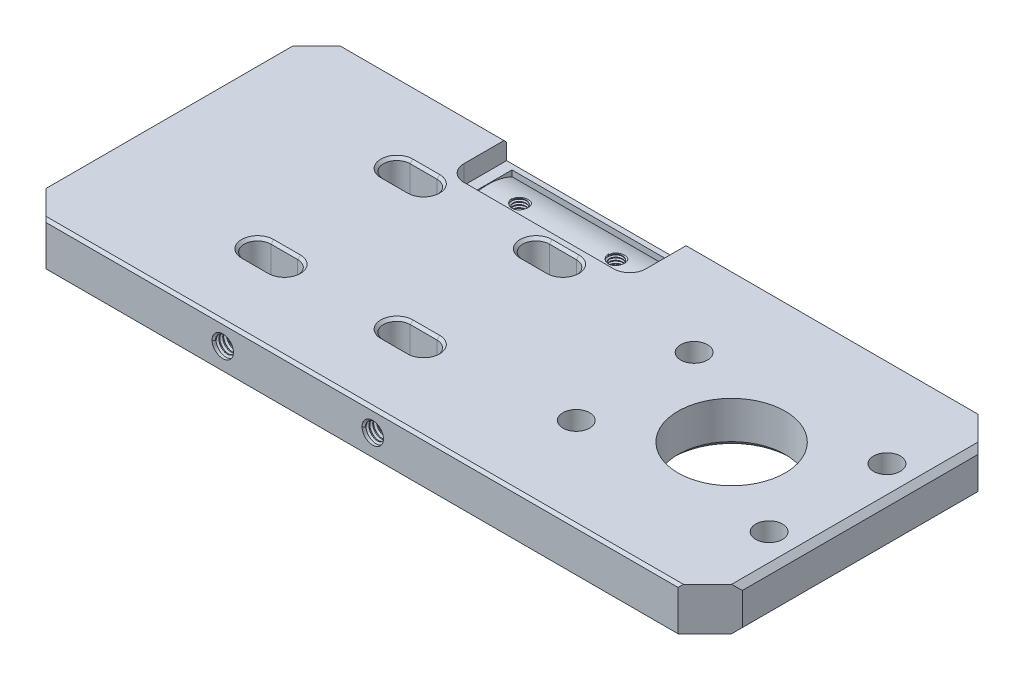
SolidWorks part; units mm, degrees
ref_plane "Спереди" through (0, 0, 0) normal (0, 0, 1) x (1, 0, 0)
ref_plane "Сверху" through (0, 0, 0) normal (0, 1, 0) x (1, 0, 0)
ref_plane "Справа" through (0, 0, 0) normal (1, 0, 0) x (0, 0, -1)
sketch "Эскиз1" plane through (0, 0, 0) normal (0, 1, 0) x (1, 0, 0)
  line L0 (-49.5, 15.5) -> (-44.5, 15.5)
  line L1 (-106, 28) -> (24, 28)
  line L2 (-106, 28) -> (-106, -28)
  line L3 (-106, -28) -> (24, -28)
  line L4 (24, 28) -> (24, -28)
  line L5 (-75.5, 15.5) -> (-70.5, 15.5)
  line L6 (-49.5, 10.5) -> (-44.5, 10.5)
  line L7 (-75.5, 10.5) -> (-70.5, 10.5)
  line L8 (-49.5, -10.5) -> (-44.5, -10.5)
  line L9 (-49.5, -15.5) -> (-44.5, -15.5)
  line L10 (-75.5, -10.5) -> (-70.5, -10.5)
  line L11 (-75.5, -15.5) -> (-70.5, -15.5)
  line L12 (-70.5, -13) -> (-75.5, -13) construction
  line L13 (-49.5, -13) -> (-44.5, -13) construction
  line L14 (-75.5, 13) -> (-70.5, 13) construction
  line L15 (-49.5, 13) -> (-44.5, 13) construction
  line L16 (-73, 10.5) -> (-73, 15.5) construction
  line L17 (-47, 10.5) -> (-47, 15.5) construction
  line L18 (-73, -15.5) -> (-73, -10.5) construction
  line L19 (-47, -15.5) -> (-47, -10.5) construction
  line L20 (-60, 23.7139) -> (-60, -45.8152) construction
  line L21 (0, 0) -> (58.925, 0) construction
  line L22 (0, 0) -> (0, -35.0591) construction
  circle A0 centre (0, 0) radius 10
  arc A1 (-70.5, 15.5) -> (-70.5, 10.5) centre (-70.5, 13) cw
  arc A2 (-75.5, 15.5) -> (-75.5, 10.5) centre (-75.5, 13) ccw
  arc A3 (-44.5, 15.5) -> (-44.5, 10.5) centre (-44.5, 13) cw
  arc A4 (-49.5, 15.5) -> (-49.5, 10.5) centre (-49.5, 13) ccw
  arc A5 (-44.5, -10.5) -> (-44.5, -15.5) centre (-44.5, -13) cw
  arc A6 (-49.5, -10.5) -> (-49.5, -15.5) centre (-49.5, -13) ccw
  arc A7 (-70.5, -10.5) -> (-70.5, -15.5) centre (-70.5, -13) cw
  arc A8 (-75.5, -10.5) -> (-75.5, -15.5) centre (-75.5, -13) ccw
  circle A9 centre (18, 11) radius 2.5
  circle A10 centre (-18, 11) radius 2.5
  circle A11 centre (-18, -11) radius 2.5
  circle A12 centre (18, -11) radius 2.5
  dimension "D3" = 20
  dimension "D4" = 28
  dimension "D5" = 60
  dimension "D8" = 2
  dimension "D14" = 18
  dimension "D16" = 5
  dimension "D1" = 56
  dimension "D2" = 130
  dimension "D6" = 5
  dimension "D7" = 5
  dimension "D10" = 12.5
  dimension "D11" = 24
  dimension "D12" = 12.5
  dimension "D13" = 21
  dimension "D15" = 11
  dimension "D9" = 2
extrude "Бобышка-Вытянуть1" add sketch "Эскиз1" along normal blind 8
sketch "Эскиз2" plane through (0, 8, 0) normal (0, 1, 0) x (1, 0, 0)
  line L1 (-70, 28) -> (-36, 28)
  line L2 (-70, 28) -> (-70, 20)
  line L3 (-67, 17) -> (-39, 17)
  line L4 (-36, 28) -> (-36, 20)
  line L5 (-106, 28) -> (-106, -28) construction
  line L6 (24, 28) -> (-106, 28) construction
  arc A0 (-36, 20) -> (-39, 17) centre (-39, 20) cw
  arc A1 (-70, 20) -> (-67, 17) centre (-67, 20) ccw
  point P1 (-70, 18.5362)
  point P2 (-36.4032, 18.6837)
  point P4 (-70, -6.474)
  point P5 (-70, 28)
  point P10 (-36, 17)
  point P13 (-70, 17)
  point P14 (0, 0)
  point P17 (-39, 21.6837)
  point P18 (-36, 17)
  point P21 (-70, 17)
  dimension "D4" = 3
  dimension "D1" = 36
  dimension "D2" = 34
  dimension "D3" = 11
extrude "Вырез-Вытянуть1" cut sketch "Эскиз2" against normal blind 3.5
sketch "Эскиз3" plane through (0, 8, 0) normal (0, 1, 0) x (1, 0, 0)
  line L0 (-36, 20) -> (-36, 28) construction
  line L2 (-36, 28) -> (-70, 28) construction
  circle A0 centre (-62, 22.5) radius 1.5
  circle A1 centre (-44, 22.5) radius 1.5
  point P8 (-44, 22.5)
  point P9 (-62, 22.5)
  point P10 (-44, 22.5)
  dimension "D1" = 18
  dimension "D2" = 8
  dimension "D3" = 5.5
  dimension "D4" = 3
extrude "Вырез-Вытянуть2" cut sketch "Эскиз3" against normal through all
thread "Резьба1" pitch 0.5 start angle 0, offset 0, length 4.5, pitch 0.5, diameter 3
ref_plane "Плоскость1" through (-45.5, 4.5, -22.5) normal (0, 0, 1) x (-1, 0, 0)
sketch "Профиль резьбы1" plane through (-45.5, 4.5, -22.5) normal (0, 0, 1) x (-1, 0, 0)
  line L0 (0, 0) -> (0, 0.5) construction
  line L11 (0, 0) -> (0, 0.4375)
  line L12 (0, 0.4375) -> (-0.2706, 0.2812)
  line L13 (-0.2706, 0.2812) -> (-0.2706, 0.1562)
  line L15 (-0.2706, 0.1562) -> (0, 0)
  line L17 (-0.2706, 0.2187) -> (0, 0.2187) construction
  point P2 (0, 0)
  dimension "Pitch" = 0.5
  dimension "Profile_Angle" = 60
  dimension "Profile_Land" = 0.125
  dimension "Profile_Height" = 0.2706
thread "Резьба2" pitch 0.5 start angle 0, offset 0, length 4.5, pitch 0.5, diameter 3
ref_plane "Плоскость2" through (-63.5, 4.5, -22.5) normal (0, 0, 1) x (-1, 0, 0)
sketch "Профиль резьбы2" plane through (-63.5, 4.5, -22.5) normal (0, 0, 1) x (-1, 0, 0)
  line L0 (0, 0) -> (0, 0.5) construction
  line L11 (0, 0) -> (0, 0.4375)
  line L12 (0, 0.4375) -> (-0.2706, 0.2812)
  line L13 (-0.2706, 0.2812) -> (-0.2706, 0.1562)
  line L15 (-0.2706, 0.1562) -> (0, 0)
  line L17 (-0.2706, 0.2187) -> (0, 0.2187) construction
  point P2 (0, 0)
  dimension "Pitch" = 0.5
  dimension "Profile_Angle" = 60
  dimension "Profile_Land" = 0.125
  dimension "Profile_Height" = 0.2706
chamfer "Chanfrein1" distance 6 angle 45 4 edges at (-106, 4, 28) (-106, 4, -28) (24, 4, 28) (24, 4, -28)
chamfer "Фаска1" distance 1 angle 45 4 edges at (-106, 0, 0) (-106, 8, 0) (24, 0, 0) (24, 8, 0)
chamfer "Фаска2" distance 0.5 angle 45 24 edges at (-42, 0, 13) (-47, 0, 15.5) (-52, 0, 13) (-47, 0, 10.5) (-47, 8, -15.5) (-52, 8, -13) (-42, 8, -13) (-47, 8, -10.5) (-47, 0, -10.5) (-42, 0, -13) (-47, 0, -15.5) (-52, 0, -13) (-73, 8, 10.5) (-78, 8, 13) (-68, 8, 13) (-73, 8, 15.5) (-73, 0, 15.5) (-68, 0, 13) (-78, 0, 13) (-73, 0, 10.5) (-68, 0, -13) (-73, 0, -10.5) (-78, 0, -13) (-73, 0, -15.5)
chamfer "Фаска3" distance 1 angle 45 1 edges at (0, 0, 10)
chamfer "Фаска4" distance 0.5 angle 45 8 edges at (-42, 8, 13) (-47, 8, 15.5) (-52, 8, 13) (-47, 8, 10.5) (-73, 8, -10.5) (-68, 8, -13) (-73, 8, -15.5) (-78, 8, -13)
sketch "Эскиз9" plane through (0, 0, 28) normal (0, 0, -1) x (-1, 0, 0)
  line L0 (-18, 0) -> (100, 0) construction
  line L1 (106, 7) -> (106, 1) construction
  circle A0 centre (67, 4) radius 2
  circle A1 centre (39, 4) radius 2
  dimension "D1" = 4
  dimension "D2" = 4
  dimension "D3" = 4
  dimension "D4" = 39
  dimension "D5" = 28
extrude "Вырез-Вытянуть3" cut sketch "Эскиз9" along normal blind 10
chamfer "Фаска5" distance 0.5 angle 45 3 edges at (-85, 8, -28) (-9, 8, -28) (-41, 8, 28)
thread "Резьба3" pitch 0.7 start angle 0, offset 0, length 9, pitch 0.7, diameter 4
ref_plane "Плоскость4" through (-69, 4, 28) normal (0, -1, 0) x (-1, 0, 0)
sketch "Профиль резьбы4" plane through (-69, 4, 28) normal (0, -1, 0) x (-1, 0, 0)
  line L0 (0, 0) -> (0, 0.7) construction
  line L11 (0, 0) -> (0, 0.6125)
  line L12 (0, 0.6125) -> (-0.3789, 0.3937)
  line L13 (-0.3789, 0.3937) -> (-0.3789, 0.2187)
  line L15 (-0.3789, 0.2187) -> (0, 0)
  line L17 (-0.3789, 0.3062) -> (0, 0.3062) construction
  point P2 (0, 0)
  dimension "Pitch" = 0.7
  dimension "Profile_Angle" = 60
  dimension "Profile_Land" = 0.175
  dimension "Profile_Height" = 0.3789
thread "Резьба4" pitch 0.7 start angle 0, offset 0, length 9, pitch 0.7, diameter 4
ref_plane "Плоскость5" through (-41, 4, 28) normal (0, -1, 0) x (-1, 0, 0)
sketch "Профиль резьбы5" plane through (-41, 4, 28) normal (0, -1, 0) x (-1, 0, 0)
  line L0 (0, 0) -> (0, 0.7) construction
  line L11 (0, 0) -> (0, 0.6125)
  line L12 (0, 0.6125) -> (-0.3789, 0.3937)
  line L13 (-0.3789, 0.3937) -> (-0.3789, 0.2187)
  line L15 (-0.3789, 0.2187) -> (0, 0)
  line L17 (-0.3789, 0.3062) -> (0, 0.3062) construction
  point P2 (0, 0)
  dimension "Pitch" = 0.7
  dimension "Profile_Angle" = 60
  dimension "Profile_Land" = 0.175
  dimension "Profile_Height" = 0.3789
sketch "Эскиз19" plane through (-106, 0, 0) normal (-1, 0, 0) x (0, 0, 1)
  line L0 (-23, 8) -> (23, 8) construction
  line L1 (28, 7) -> (28, 1) construction
  line L2 (-28, 7) -> (-28, 1) construction
  circle A0 centre (-18, 4) radius 2
  circle A1 centre (18, 4) radius 2
  dimension "D1" = 4
  dimension "D3" = 4
  dimension "D4" = 10
  dimension "D5" = 10
  dimension "D2" = 4
extrude "Вырез-Вытянуть4" cut sketch "Эскиз19" against normal blind 10
chamfer "Фаска6" distance 0.5 angle 45 2 edges at (-106, 4, 20) (-106, 4, -16)
thread "Резьба5" pitch 0.7 start angle 0, offset 0, length 9, pitch 0.7, diameter 4
ref_plane "Плоскость6" through (-96, 4, -16) normal (0, -1, 0) x (0, 0, 1)
sketch "Профиль резьбы6" plane through (-96, 4, -16) normal (0, -1, 0) x (0, 0, 1)
  line L0 (0, 0) -> (0, 0.7) construction
  line L11 (0, 0) -> (0, 0.6125)
  line L12 (0, 0.6125) -> (-0.3789, 0.3937)
  line L13 (-0.3789, 0.3937) -> (-0.3789, 0.2187)
  line L15 (-0.3789, 0.2187) -> (0, 0)
  line L17 (-0.3789, 0.3062) -> (0, 0.3062) construction
  point P2 (0, 0)
  dimension "Pitch" = 0.7
  dimension "Profile_Angle" = 60
  dimension "Profile_Land" = 0.175
  dimension "Profile_Height" = 0.3789
thread "Резьба6" pitch 0.7 start angle 0, offset 0, length 9, pitch 0.7, diameter 4
ref_plane "Плоскость7" through (-96, 4, 20) normal (0, -1, 0) x (0, 0, 1)
sketch "Профиль резьбы7" plane through (-96, 4, 20) normal (0, -1, 0) x (0, 0, 1)
  line L0 (0, 0) -> (0, 0.7) construction
  line L11 (0, 0) -> (0, 0.6125)
  line L12 (0, 0.6125) -> (-0.3789, 0.3937)
  line L13 (-0.3789, 0.3937) -> (-0.3789, 0.2187)
  line L15 (-0.3789, 0.2187) -> (0, 0)
  line L17 (-0.3789, 0.3062) -> (0, 0.3062) construction
  point P2 (0, 0)
  dimension "Pitch" = 0.7
  dimension "Profile_Angle" = 60
  dimension "Profile_Land" = 0.175
  dimension "Profile_Height" = 0.3789
ref_plane "Plan1" through (-53, 0, 0) normal (1, 0, 0) x (0, 0, -1)
sketch "Esquisse1" plane through (-53, 0, 0) normal (1, 0, 0) x (0, 0, -1)
  line L0 (18, 3.3974) -> (27, 3.3974) construction
  line L1 (18, 3.3974) -> (18, 11.3974)
  line L2 (18, 11.3974) -> (27, 11.3974)
  line L3 (27, 11.3974) -> (27, 3.3974)
  line L4 (28, 4.5) -> (20, 4.5) construction
  line L7 (28, 4.5) -> (28, 7.5) construction
  line L8 (17, 4.5) -> (17, 8) construction
  arc A0 (27, 3.3974) -> (18, 3.3974) centre (22.5, -6.2) ccw
  point P1 (22.5, 4.4)
  point P6 (-27, 3.2722)
  point P9 (23.2238, 3.1121)
  point P12 (18.4496, 3.4996)
  dimension "D5" = 10.6
  dimension "D1" = 0.1
  dimension "D2" = 1
  dimension "D3" = 1
  dimension "D4" = 8
extrude "Enlèv. mat.-Extru.1" cut sketch "Esquisse1" against normal mid plane 30
